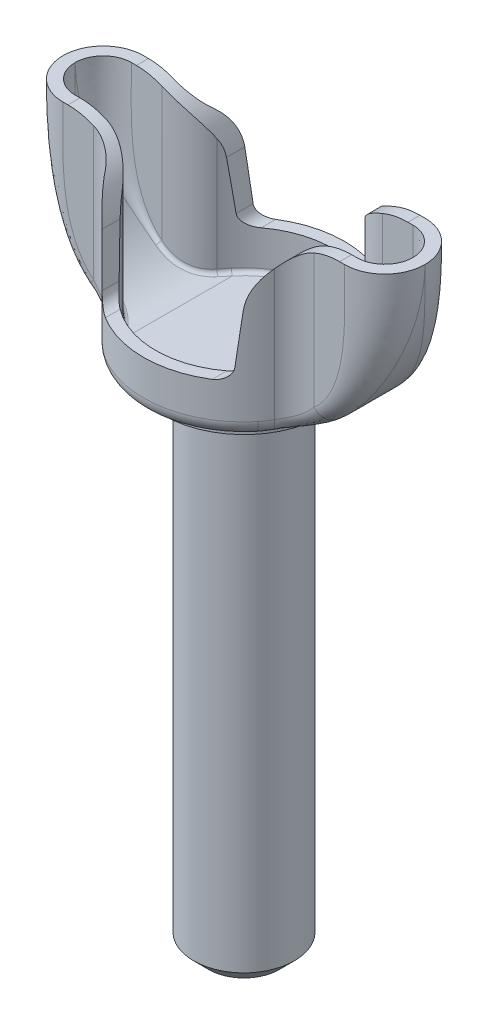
SolidWorks part; units mm, degrees
ref_plane "Front Plane" through (0, 0, 0) normal (0, 0, 1) x (1, 0, 0)
ref_plane "Top Plane" through (0, 0, 0) normal (0, 1, 0) x (1, 0, 0)
ref_plane "Right Plane" through (0, 0, 0) normal (1, 0, 0) x (0, 0, -1)
other "Configuration Table"
sketch "ReferSke" plane through (0, 0, 0) normal (0, 0, 1) x (1, 0, 0)
  line L0 (0, 0) -> (0, -18) construction
sketch "HeadSke" plane through (0, 0, 0) normal (0, 1, 0) x (1, 0, 0)
  line L0 (0, 73.6257) -> (0, -72.8166) construction
  line L1 (18, -4) -> (9.1652, -4)
  line L2 (-18, -4) -> (-9.1652, -4)
  line L3 (0, 0) -> (40.2198, 0) construction
  line L4 (-18, 4) -> (-9.1652, 4)
  line L5 (18, 4) -> (9.1652, 4)
  line L6 (-18, 4) -> (-18, -4)
  line L7 (18, -4) -> (18, 4)
  arc A0 (-9.1652, -4) -> (9.1652, -4) centre (0, 0) ccw
  arc A2 (9.1652, 4) -> (-9.1652, 4) centre (0, 0) ccw
extrude "Head" add sketch "HeadSke" against normal blind 17.1
sketch "CutHeadSke" plane through (0, 0, 0) normal (0, 0, 1) x (1, 0, 0)
  line L0 (0, 0) -> (0, -18.7628) construction
  line L1 (-18, 0) -> (-13.506, 0)
  line L2 (-7.0308, -5.9335) -> (-6.5, -12)
  line L3 (-6.5, -12) -> (6.5, -12)
  line L4 (6.5, -17.1) -> (-6.5, -17.1)
  line L5 (-9.1652, -17.1) -> (9.1652, -17.1) construction
  line L6 (-18, 0) -> (-18, 13.115) construction
  line L8 (-18, -17.1) -> (-18, 0) construction
  line L10 (18, 0) -> (13.506, 0)
  line L11 (7.0308, -5.9335) -> (6.5, -12)
  line L12 (-18, -17.1) -> (-18, 0) construction
  line L13 (-25, 3) -> (25, 3)
  line L14 (-25, 3) -> (-25, -22)
  line L15 (-25, -22) -> (25, -22)
  line L16 (25, 3) -> (25, -22)
  line L17 (-18, 0) -> (-9.1652, 0) construction
  line L18 (-18, 0) -> (-9.1652, 0) construction
  arc A1 (-13.506, 0) -> (-7.0308, -5.9335) centre (-13.506, -6.5) cw
  arc A3 (13.506, 0) -> (7.0308, -5.9335) centre (13.506, -6.5) ccw
  ellipse E0 centre (6.5, 0) end of major axis (6.5, -17.1) minor radius 11.5 (6.5, -17.1) -> (18, 0) ccw
  ellipse E1 centre (-6.5, 0) end of major axis (-6.5, -17.1) minor radius 11.5 (-6.5, -17.1) -> (-18, 0) cw
  point P18 (0, -17.1)
  point P24 (0, -12)
extrude "CutHead" cut sketch "CutHeadSke" against normal mid plane 20
fillet "Fillet1" radius 3 4 edges at (-9.1652, -9.1482, 4) (9.1652, -9.1482, 4) (-9.1652, -9.1482, -4) (9.1652, -9.1482, -4)
fillet "WingFillet" radius 1.6 4 edges at (16.078, -9.4643, 4) (16.078, -9.4643, -4) (-16.078, -9.4643, -4) (-16.078, -9.4643, 4)
shell "Shell"
fillet "Fillet2" radius 1.3 4 edges at (6.5, -12, 6.7657) (6.5, -12, -6.7657) (-6.5, -12, -6.7657) (-6.5, -12, 6.7657)
sketch "BodySke" plane through (0, 0, 0) normal (0, 0, 1) x (1, 0, 0)
  line L0 (0, -15.9) -> (-8, -15.9)
  line L1 (-8, -15.9) -> (-8, -18)
  line L2 (-8, -18) -> (-5, -18)
  line L3 (-5, -18) -> (-5, -68)
  line L4 (-5, -68) -> (0, -68)
  line L5 (0, -68) -> (0, -15.9)
  line L7 (0, 0) -> (0, -86.7611) construction
  line L8 (6.5, -15.9) -> (-6.5, -15.9) construction
  line L9 (-4.172, -48.3988) -> (-4.172, -77.8075) construction
  line L10 (2.3461, -66.5) -> (-10.2468, -66.5) construction
revolve "BaseBody" add sketch "BodySke" angle 360 about L7
sketch "ChamferedEndSke" plane through (0, 0, 0) normal (0, 0, 1) x (1, 0, 0)
  line L0 (-3.5, -68) -> (-5, -68)
  line L1 (-5, -68) -> (-5, -66.5)
  line L2 (-5, -66.5) -> (-3.5, -68)
  line L5 (0, 0) -> (0, -120.2191) construction
revolve "ChamferedEnd" cut sketch "ChamferedEndSke" angle 360 about L5
sketch "CutEndSke" plane through (0, -68, 0) normal (0, -1, 0) x (1, 0, 0)
  circle A0 centre (0, 0) radius 5 construction
  circle A1 centre (0, 0) radius 5
extrude "CutEnd" [suppressed] cut sketch "CutEndSke" against normal blind 1.5
dome "RoundedEnd" [suppressed] faces to dome 1 distance 1.5 parameters "D1"=1.5
sketch "ThdSchSke" plane through (0, 0, 0) normal (0, 0, 1) x (1, 0, 0)
  line L1 (24.1558, -68) -> (-21.9887, -68) construction
  line L2 (5, -67.203) -> (4.172, -66.725)
  line L3 (4.172, -66.725) -> (5, -66.247)
  line L4 (5, -66.247) -> (5.9561, -66.247)
  line L5 (5.9561, -66.247) -> (5.9561, -67.203)
  line L6 (5.9561, -67.203) -> (5, -67.203)
  line L7 (0, 0) -> (0, -81.9048) construction
  line L8 (-8, -18) -> (8, -18) construction
revolve "ThreadSchematic" [suppressed] cut sketch "ThdSchSke" angle 360 about L7
pattern_linear "ThdSchPat" [suppressed] count 32 along (0, -1, 0)
equation "\"Height@Head\" = \"Head_height@ReferSke\"*0.95"
equation "\"D3@CutHeadSke\" = \"Base_width@CutHeadSke\"/2"
equation "\"D1@CutHead\" = \"Mid_width@HeadSke\""
equation "\"D1@Fillet1\" = \"Mid_width@HeadSke\"*0.15"
equation "\"D3@WingFillet\" = \"Wing_width@HeadSke\"/2"
equation "\"D0@WingFillet\" = \"Wing_width@HeadSke\"/2"
equation "\"D7@WingFillet\" = \"Wing_width@HeadSke\"/2"
equation "\"D4@WingFillet\" = \"Wing_width@HeadSke\"/2"
equation "\"D5@WingFillet\" = \"Wing_width@HeadSke\"/5"
equation "\"D2@WingFillet\" = \"Wing_width@HeadSke\"/5"
equation "\"D6@WingFillet\" = \"Wing_width@HeadSke\"/5"
equation "\"D1@WingFillet\" = \"Wing_width@HeadSke\"/5"
equation "\"D1@Fillet2\" = \"Base_width@CutHeadSke\"/10"
equation "\"Thread_minor@ThreadCosmetic\" = \"Minor_dia@BodySke\""
equation "\"D1@CutEnd\" = \"Chamfer_width@ChamferedEndSke\""
equation "\"D1@RoundedEnd\" = \"Chamfer_width@ChamferedEndSke\""
equation "\"Length@ThdSchSke\" = \"Length@BodySke\""
equation "\"D3@ThdSchSke\" = \"Advance@BodySke\" * 0.85"
equation "\"D2@ThdSchSke\" = \"Diameter@BodySke\""
equation "\"D1@ThdSchSke\" = \"Minor_dia@BodySke\""
equation "\"Advance@ThdSchPat\" = \"Advance@BodySke\""
equation "\"D1@ThdSchPat\" =  int( \"Length@BodySke\" / \"Advance@BodySke\" ) -1"
